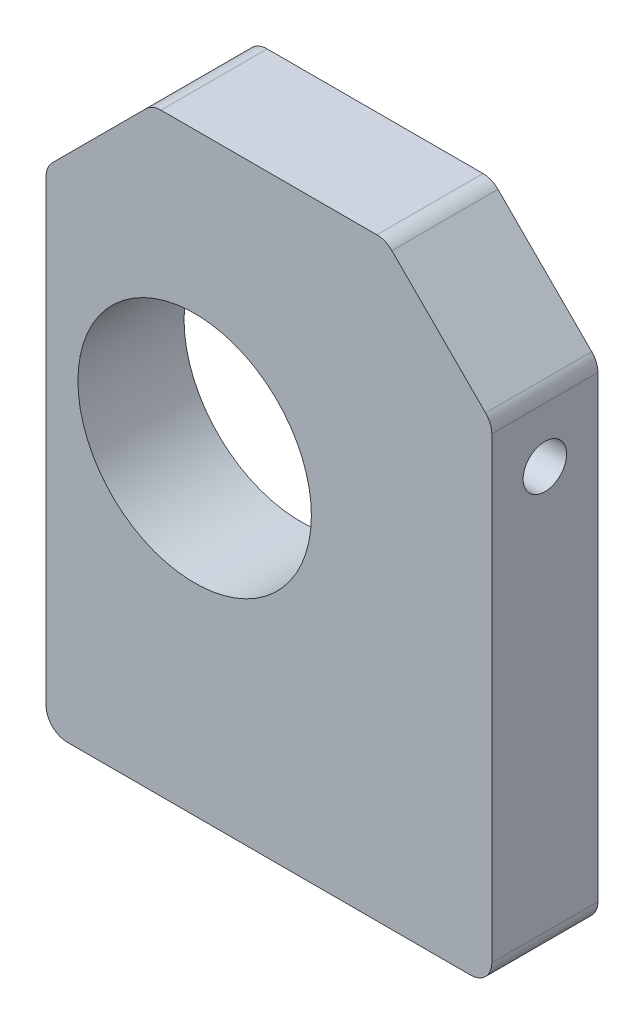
SolidWorks part; units mm, degrees
ref_plane "前视基准面" through (0, 0, 0) normal (0, 0, 1) x (1, 0, 0)
ref_plane "上视基准面" through (0, 0, 0) normal (0, 1, 0) x (1, 0, 0)
ref_plane "右视基准面" through (0, 0, 0) normal (1, 0, 0) x (0, 0, -1)
other "Configuration Table"
sketch "草图1" plane through (0, 0, 0) normal (0, 0, 1) x (1, 0, 0)
  line L1 (0, 0) -> (21, 0)
  line L2 (0, 0) -> (0, 23.0003)
  line L3 (4.9997, 28) -> (16, 28)
  line L4 (21, 0) -> (21, 23)
  line L5 (4.9997, 28) -> (0, 23.0003)
  line L8 (21, 23) -> (16, 28)
  circle A0 centre (7, 15) radius 5.5
  dimension "D9" = 11
  dimension "D1" = 21
  dimension "D2" = 45
  dimension "D3" = 45
  dimension "D4" = 28
  dimension "D5" = 23
  dimension "D6" = 23.0003
  dimension "D7" = 7
  dimension "D8" = 15
extrude "凸台-拉伸1" add sketch "草图1" along normal blind 5
hole_wizard "M2.5 螺纹孔1" positions "草图3" profile "草图4" tap size "M2.5" standard "GB"
sketch "草图3" plane through (21, 0, 0) normal (1, 0, 0) x (0, 0, -1)
  line L0 (-5, 23) -> (0, 23) construction
  line L1 (-5, 0) -> (-5, 23) construction
  point P0 (-2.5, 20)
  dimension "D1" = 3
  dimension "D2" = 2.5
sketch "草图4" plane through (21, 20, 2.5) normal (0, 1, 0) x (0, 0, -1)
  line L0 (0, 0) -> (0, 2.6159)
  line L1 (0, 2.6159) -> (1.025, 2)
  line L2 (1.025, 2) -> (1.025, 0)
  line L5 (1.025, 0) -> (0, 0)
  line L10 (0, 2.6159) -> (-1.025, 2) construction
  line L11 (0, -6.35) -> (0, 107.95) construction
  dimension "螺纹孔钻头直径" = 2.05
  dimension "螺纹孔钻头深度" = 2
  dimension "导头角度" = 118
hole_wizard "M2.5 螺纹孔2" positions "草图5" profile "草图6" tap size "M2.5" standard "GB"
sketch "草图5" plane through (0, 0, 0) normal (0, -1, 0) x (-1, 0, 0)
  line L0 (-21, -5) -> (-21, 0) construction
  line L1 (0, -5) -> (0, 0) construction
  line L2 (0, 0) -> (-21, 0) construction
  point P0 (-13, -2.5)
  point P2 (-3.5, -2.5)
  dimension "D1" = 8
  dimension "D2" = 3.5
  dimension "D3" = 2.5
  dimension "D4" = 2.5
sketch "草图6" plane through (13, 0, 2.5) normal (1, 0, 0) x (0, 0, -1)
  line L0 (0, 0) -> (0, 2.6159)
  line L1 (0, 2.6159) -> (1.025, 2)
  line L2 (1.025, 2) -> (1.025, 0)
  line L5 (1.025, 0) -> (0, 0)
  line L10 (0, 2.6159) -> (-1.025, 2) construction
  line L11 (0, -6.35) -> (0, 107.95) construction
  dimension "螺纹孔钻头直径" = 2.05
  dimension "螺纹孔钻头深度" = 2
  dimension "导头角度" = 118
fillet "圆角1" radius 1 6 edges at (21, 0, 2.5) (0, 0, 2.5) (0, 23.0003, 2.5) (4.9997, 28, 2.5) (16, 28, 2.5) (21, 23, 2.5)
